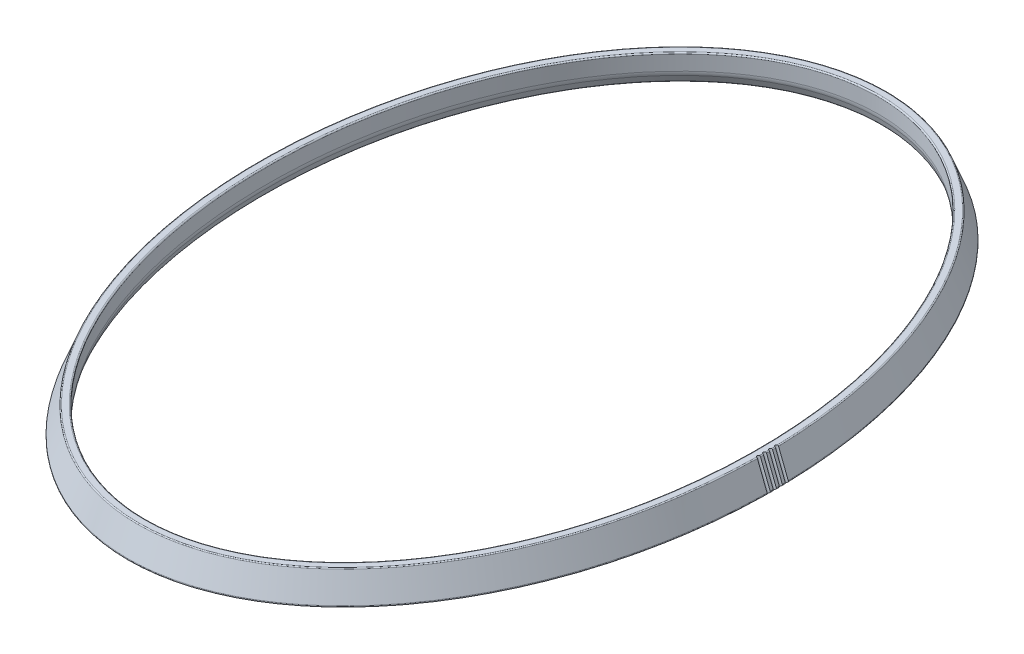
SolidWorks part; units mm, degrees
ref_plane "Front Plane" through (0, 0, 0) normal (0, 0, 1) x (1, 0, 0)
ref_plane "Top Plane" through (0, 0, 0) normal (0, 1, 0) x (1, 0, 0)
ref_plane "Right Plane" through (0, 0, 0) normal (1, 0, 0) x (0, 0, -1)
sketch "Sketch2" plane through (0, 0, 0) normal (0, 1, 0) x (1, 0, 0)
  line L0 (0, 60) -> (0, 0) construction
  ellipse E0 centre (0, 0) end of major axis (0, 60) minor radius 40 construction
  point P1 (0, 60.4)
  dimension "D2" = 80
  dimension "D1" = 120
  dimension "D3" = 0.4
sketch "Sketch4" plane through (0, 0, 0) normal (1, 0, 0) x (0, 0, -1)
  line L0 (60.4, 0) -> (60.4, -3)
  line L1 (60.4, -3) -> (60.946, -4.5)
  line L2 (60.946, -4.5) -> (63.4, -4.5)
  line L3 (63.4, -4.5) -> (61.65, 0)
  line L4 (61.65, 0) -> (60.4, 0)
  dimension "D1" = 1.25
  dimension "D2" = 3
  dimension "D3" = 4.5
  dimension "D4" = 20
  dimension "D5" = 3
sweep "Sweep1" add profiles "Sketch4" path "Sketch2"
sketch "Sketch9" plane through (0, 0, 0) normal (0, 0, 1) x (1, 0, 0)
  line L0 (43.4, -4.5) -> (41.65, 0) construction
  line L1 (43.4, -4.5) -> (41.65, 0)
fillet "Fillet1" radius 2 1 edges
fillet "Fillet2" radius 0.2 4 edges
ref_plane "Plane2" through (41.65, 0, 0) normal (-0.3624, 0.932, 0) x (0.932, 0.3624, 0)
sketch "Sketch13" plane through (41.65, 0, 0) normal (-0.3624, 0.932, 0) x (0.932, 0.3624, 0)
  circle A0 centre (0, 0) radius 0.25
  circle A1 centre (-0.0051, 1) radius 0.25
  circle A2 centre (-0.0051, -1) radius 0.25
  circle A4 centre (-0.0204, 1.9999) radius 0.25
  spline S0 degree 3 number of poles 145 (-38.8642, 61.6996) -> (-38.8642, 61.6996) construction
  spline S1 degree 3 number of poles 145 (-38.8642, 61.6996) -> (-38.8642, 61.6996) construction
  dimension "D1" = 0.5
  dimension "D2" = 0.5
  dimension "D3" = 1
  dimension "D4" = 1
  dimension "D5" = 1
extrude "Cut-Extrude1" cut sketch "Sketch13" against normal through all both and the other way through all
